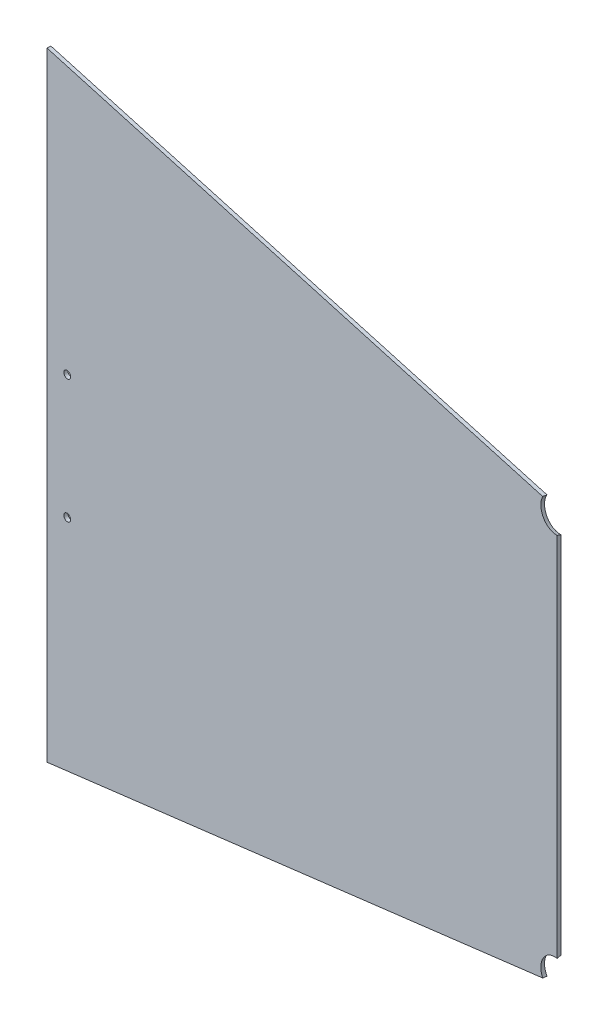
SolidWorks part; units mm, degrees
ref_plane "X-Y Datum" through (0, 0, 0) normal (0, 0, 1) x (1, 0, 0)
ref_plane "X-Z Datum" through (0, 0, 0) normal (0, 1, 0) x (1, 0, 0)
ref_plane "Y-Z Datum" through (0, 0, 0) normal (1, 0, 0) x (0, 0, -1)
ref_plane "Plane1" through (1.0099, 0, -13.5995) normal (0.0741, 0, -0.9973) x (-0.9973, 0, -0.0741)
ref_plane "Plane2" through (1.9503, 0, -26.2646) normal (0.0741, 0, -0.9973) x (-0.9973, 0, -0.0741)
sketch "Sketch1" plane through (1.9503, 0, -26.2646) normal (0.0741, 0, -0.9973) x (-0.9973, 0, -0.0741)
  line L0 (-183.6444, -298.45) -> (-183.6444, 298.45) construction
  line L1 (-183.6444, -298.45) -> (-826.7602, -177.8) construction
  line L2 (-826.7602, -177.8) -> (-826.7602, 177.8) construction
  line L3 (-826.7602, 177.8) -> (-183.6444, 298.45) construction
  line L4 (-183.6444, -298.45) -> (-183.6444, 298.45)
  line L5 (-183.6444, -298.45) -> (-826.7602, -177.8)
  line L6 (-826.7602, -177.8) -> (-826.7602, 177.8)
  line L7 (-826.7602, 177.8) -> (-183.6444, 298.45)
extrude "Boss-Extrude1" add sketch "Sketch1" along normal blind 3.175
ref_plane "Plane3" through (825.5, 212.9428, 150.983) normal (0, 0.3219, 0.9468) x (1, 0, 0)
sketch "Sketch2" plane through (825.5, 212.9428, 150.983) normal (0, 0.3219, 0.9468) x (1, 0, 0)
  circle A0 centre (0, 0) radius 14.2875
  dimension "D1" = 28.575
extrude "Cut-Extrude1" cut sketch "Sketch2" against normal through all contours A0
mirror "Mirror1" about plane through (0, 0, 0) normal (0, 1, 0) of "Cut-Extrude1"
sketch "Sketch3" plane through (1.9503, 0, -26.2646) normal (-0.0741, 0, 0.9973) x (0.9973, 0, 0.0741)
  line L0 (348.7444, 267.4769) -> (348.7444, -267.4769)
  line L1 (813.2196, -180.3402) -> (183.6444, -298.45) construction
  line L2 (183.6444, -298.45) -> (183.6444, 298.45) construction
  line L3 (183.6444, 298.45) -> (813.2196, 180.3402) construction
  point P5 (348.7444, 0)
  dimension "D1" = 165.1
extrude "Cut-Extrude2" cut sketch "Sketch3" against normal through all contours L0 M6 M7 M2
sketch "Sketch4" plane through (2.1855, 0, -29.4309) normal (0.0741, 0, -0.9973) x (-0.9973, 0, -0.0741)
  line L0 (-336.0444, 33) -> (-367.7944, 33) construction
  line L1 (-336.0444, -74) -> (-367.7944, -74) construction
  line L2 (-348.7444, 267.4769) -> (-348.7444, -267.4769) construction
  line L3 (-348.7444, 267.4769) -> (-348.7444, -267.4769)
  circle A0 centre (-367.7944, 33) radius 3.175
  circle A1 centre (-367.7944, -74) radius 3.175
  point P0 (-336.0444, 33)
  point P1 (-336.0444, -74)
  point P2 (-336.0444, -74)
  dimension "D1" = 6.35
  dimension "D2" = 19.05
extrude "Cut-Extrude3" cut sketch "Sketch4" against normal through all contours A0 | A1
